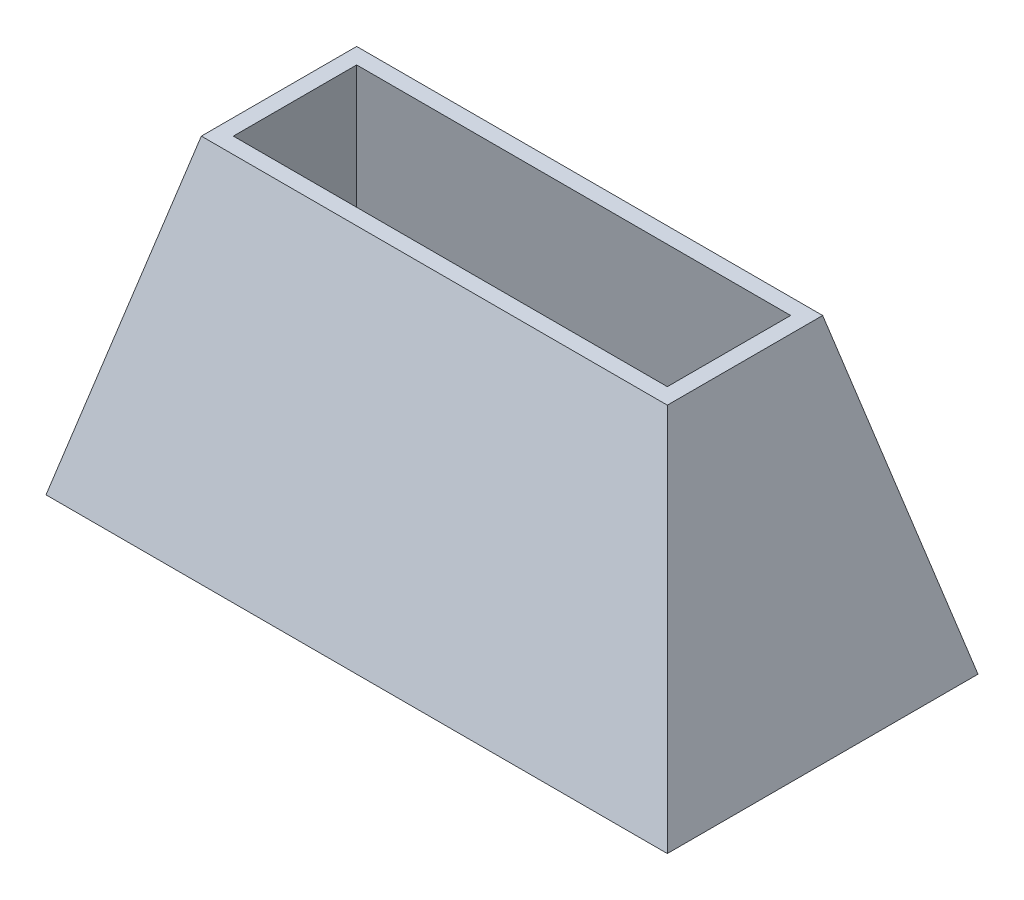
SolidWorks part; units mm, degrees
ref_plane "Front" through (0, 0, 0) normal (0, 0, 1) x (1, 0, 0)
ref_plane "Top" through (0, 0, 0) normal (0, 1, 0) x (1, 0, 0)
ref_plane "Right" through (0, 0, 0) normal (1, 0, 0) x (0, 0, -1)
ref_plane "Plane1" through (0, 50.8, 0) normal (0, 1, 0) x (1, 0, 0)
sketch "Sketch4" plane through (0, 0, 0) normal (0, 1, 0) x (1, 0, 0)
  line L1 (-50.8, -25.4) -> (50.8, -25.4)
  line L2 (-50.8, -25.4) -> (-50.8, 25.4)
  line L3 (-50.8, 25.4) -> (50.8, 25.4)
  line L4 (50.8, -25.4) -> (50.8, 25.4)
  line L5 (-50.8, -25.4) -> (50.8, 25.4) construction
  line L6 (-50.8, 25.4) -> (50.8, -25.4) construction
  point P0 (0, 0)
  dimension "D1" = 101.6
  dimension "D2" = 50.8
sketch "Sketch5" plane through (0, 50.8, 0) normal (0, 1, 0) x (1, 0, 0)
  line L8 (-38.1, 12.7) -> (-38.1, -12.7)
  line L9 (-38.1, -12.7) -> (38.1, -12.7)
  line L10 (38.1, -12.7) -> (38.1, 12.7)
  line L11 (38.1, 12.7) -> (-38.1, 12.7)
  line L12 (-38.1, 12.7) -> (-38.1, -12.7)
  line L13 (-38.1, -12.7) -> (38.1, -12.7)
  line L14 (38.1, -12.7) -> (38.1, 12.7)
  line L15 (38.1, 12.7) -> (-38.1, 12.7)
  dimension "D1" = 12.7
loft "Loft1" add profiles "Sketch4", "Sketch5"
shell "Shell1" thickness 2.54
